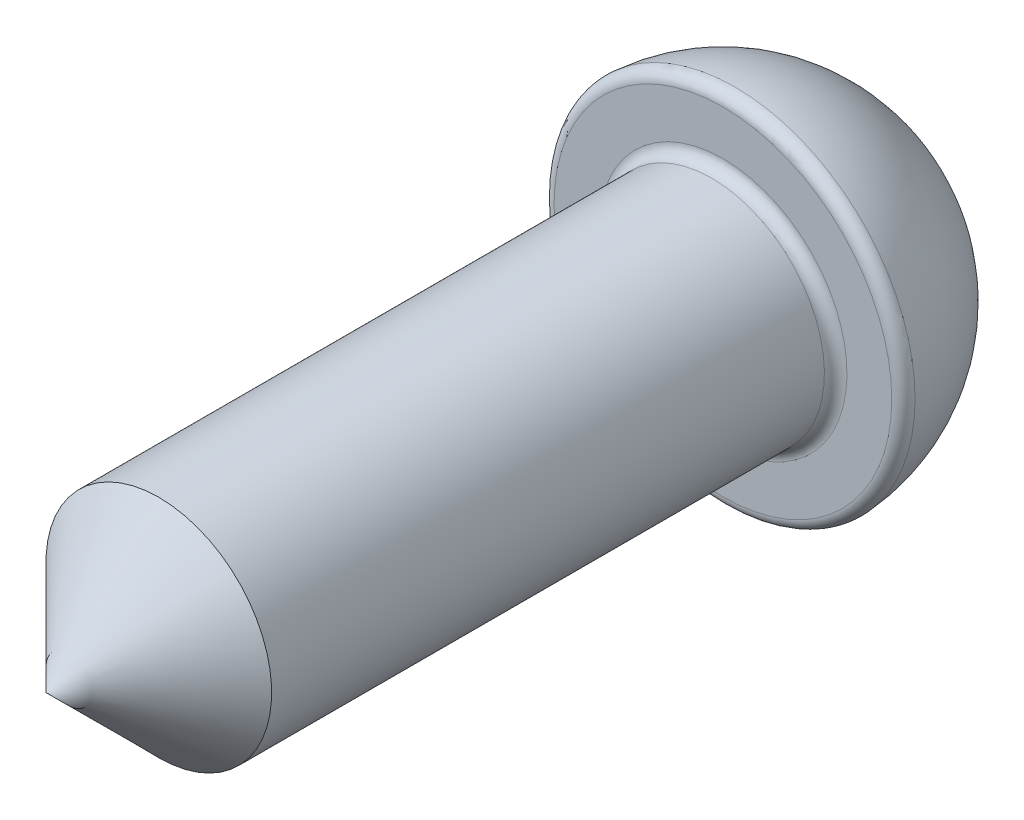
SolidWorks part; units mm, degrees
ref_plane "Спереди" through (0, 0, 0) normal (0, 0, 1) x (1, 0, 0)
ref_plane "Сверху" through (0, 0, 0) normal (0, 1, 0) x (1, 0, 0)
ref_plane "Справа" through (0, 0, 0) normal (1, 0, 0) x (0, 0, -1)
sketch "Эскиз1" plane through (0, 0, 0) normal (1, 0, 0) x (0, 0, -1)
  line L0 (-9.5, 0) -> (9.5, 0)
  line L1 (-9.5, 0) -> (-7, 2.5)
  line L2 (-7, 2.5) -> (5.5, 2.5)
  line L3 (5.5, 2.5) -> (5.5, 4)
  arc A0 (9.5, 0) -> (5.5, 4) centre (5.5, 0) ccw
  dimension "D4" = 8
  dimension "D1" = 15
  dimension "D2" = 2.5
  dimension "D3" = 45
revolve "Повернуть1" add sketch "Эскиз1" angle 360 about L0
fillet "Скругление1" radius 0.25 2 edges at (0, -4, -5.5) (0, -2.5, -5.5)
